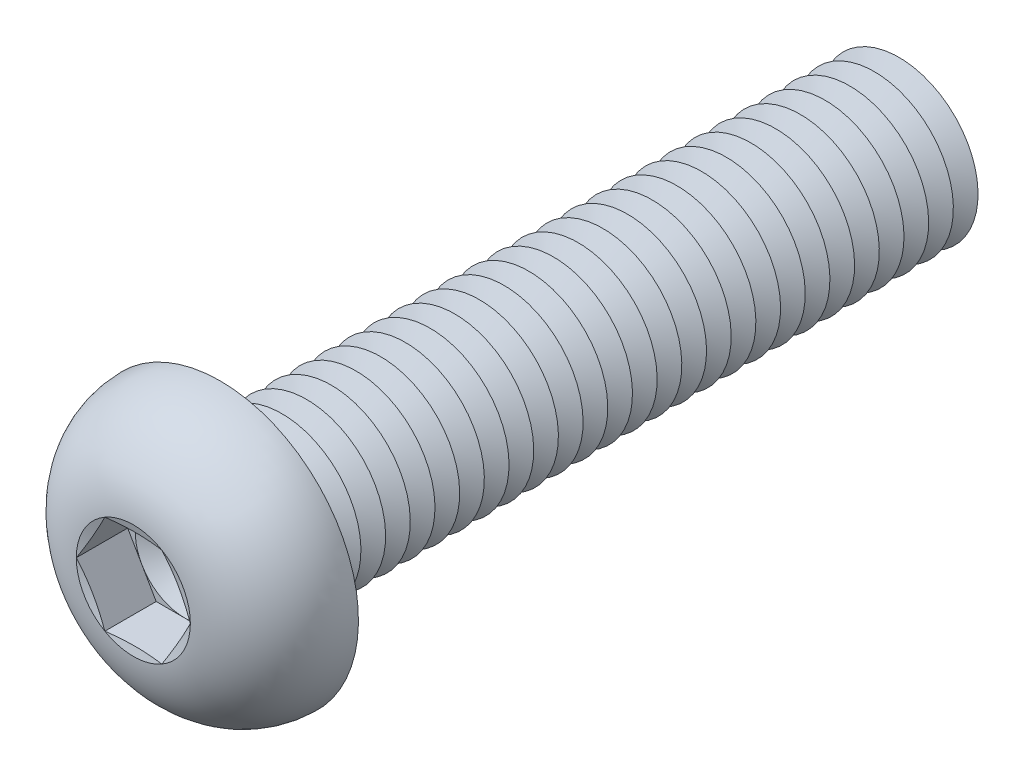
SolidWorks part; units mm, degrees
ref_plane "Front Plane" through (0, 0, 0) normal (0, 0, 1) x (1, 0, 0)
ref_plane "Top Plane" through (0, 0, 0) normal (0, 1, 0) x (1, 0, 0)
ref_plane "Right Plane" through (0, 0, 0) normal (1, 0, 0) x (0, 0, -1)
sketch "Sketch1" plane through (0, 0, 0) normal (1, 0, 0) x (0, 0, -1)
  line L0 (0, 4) -> (0, 7)
  line L3 (0, 4) -> (35, 4)
  line L4 (35, 4) -> (35, 0)
  line L5 (35, 0) -> (-4.4, 0) construction
  line L6 (-4.4, 0) -> (35, 0)
  line L7 (-4.4, 2.8867) -> (-4.4, 1.4434) construction
  line L8 (-4.4, 1.4434) -> (-4.4, 0)
  line L9 (-4.4, 2.8867) -> (-4.0132, 1.4434)
  line L10 (-4.0132, 1.4434) -> (-4.4, 1.4434)
  line L11 (35, 0) -> (22.7481, 0) construction
  line L12 (0, 7) -> (-4.4, 7) construction
  arc A1 (0, 7) -> (-4.4, 2.8867) centre (0, 2.59) ccw
  point P8 (35, 2)
  dimension "D1" = 14
  dimension "D2" = 8
  dimension "D3" = 4.4
  dimension "D4" = 5.7735
  dimension "D5" = 35
  dimension "D6" = 15
revolve "Revolve1" add sketch "Sketch1" angle 360 about L5
fillet "Fillet1" radius 0.625 1 edges at (0, 4, 0)
sketch "Sketch2" plane through (0, 0, 0) normal (1, 0, 0) x (0, 0, -1)
  line L0 (34.375, 4) -> (35.625, 4)
  line L1 (35, 4) -> (0.625, 4) construction
  line L2 (35.625, 4) -> (35, 2.9175)
  line L3 (35, -4) -> (35, 4) construction
  line L4 (35, 2.9175) -> (34.375, 4)
  dimension "D1" = 1.25
revolve "Cut-Revolve1" cut sketch "Sketch2" angle 360 about axis through (0, 0, -35) along (0, 0, -1)
pattern_linear "LPattern1" count 28 spacing 1.25 along (0, 0, 1) of "Cut-Revolve1"
sketch "Sketch3" plane through (0, 0, 4.4) normal (0, 0, 1) x (1, 0, 0)
  line L7 (1.4434, 2.5) -> (-1.4434, 2.5)
  line L8 (-1.4434, 2.5) -> (-2.8867, 0)
  line L9 (-2.8867, 0) -> (-1.4434, -2.5)
  line L10 (-1.4434, -2.5) -> (1.4434, -2.5)
  line L11 (1.4434, -2.5) -> (2.8867, 0)
  line L12 (2.8867, 0) -> (1.4434, 2.5)
  circle A0 centre (0, 0) radius 2.5 construction
  circle A3 centre (0, 0) radius 2.8867 construction
extrude "Cut-Extrude1" cut sketch "Sketch3" against normal blind 2.6
sketch "Sketch4" plane through (0, 0, 1.8) normal (0, 0, 1) x (1, 0, 0)
  line L1 (1.4434, 2.5) -> (-1.4434, 2.5) construction
  circle A0 centre (0, 0) radius 2.5
extrude "Cut-Extrude2" cut sketch "Sketch4" against normal through all draft 60
